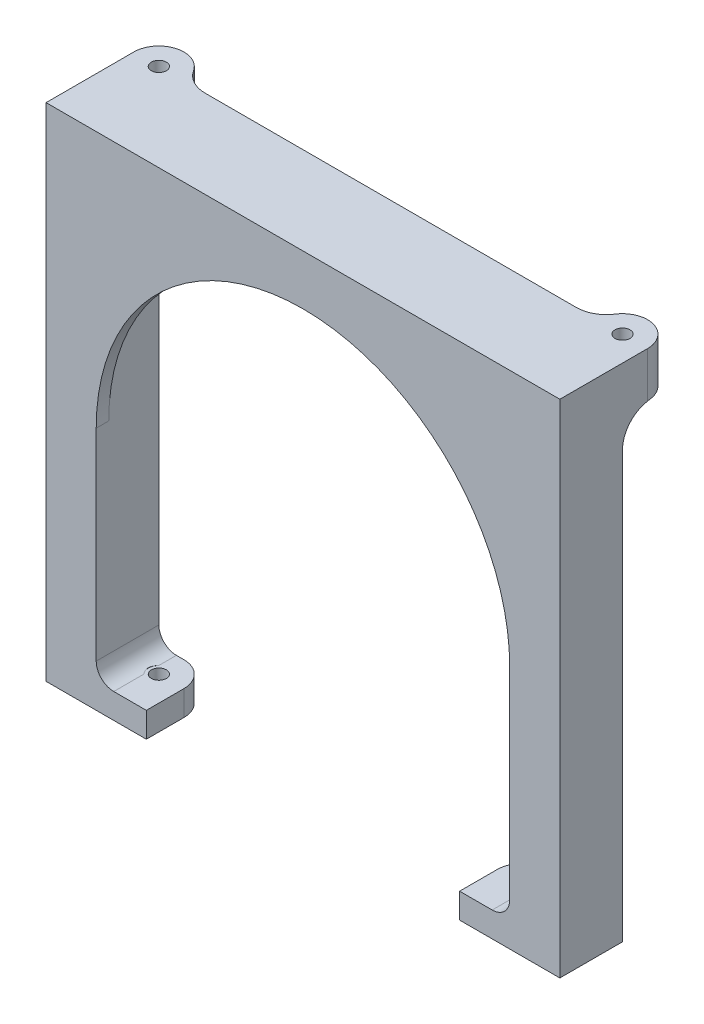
SolidWorks part; units mm, degrees
ref_plane "Front Plane" through (0, 0, 0) normal (0, 0, 1) x (1, 0, 0)
ref_plane "Top Plane" through (0, 0, 0) normal (0, 1, 0) x (1, 0, 0)
ref_plane "Right Plane" through (0, 0, 0) normal (1, 0, 0) x (0, 0, -1)
sketch "Sketch1" plane through (0, 0, 0) normal (0, 1, 0) x (1, 0, 0)
  line L0 (0, 6.35) -> (-19.05, 6.35)
  line L1 (-19.05, 6.35) -> (-19.05, -6.35)
  line L2 (-19.05, -6.35) -> (0, -6.35)
  line L3 (46.0375, 43.0465) -> (46.0375, -42.9885) construction
  line L4 (111.125, -6.35) -> (92.075, -6.35)
  line L5 (111.125, 6.35) -> (111.125, -6.35)
  line L6 (92.075, 6.35) -> (111.125, 6.35)
  line L7 (6.35, 0) -> (6.35, -6.35)
  line L8 (6.35, -6.35) -> (0, -6.35)
  line L9 (85.725, 0) -> (85.725, -6.35)
  line L10 (85.725, -6.35) -> (92.075, -6.35)
  circle A0 centre (0, 0) radius 1.905
  arc A1 (6.35, 0) -> (0, 6.35) centre (0, 0) ccw
  circle A2 centre (92.075, 0) radius 1.905
  arc A3 (85.725, 0) -> (92.075, 6.35) centre (92.075, 0) cw
  dimension "D1" = 46.0375
  dimension "D2" = 3.81
  dimension "D3" = 6.35
extrude "Boss-Extrude1" add sketch "Sketch1" along normal blind 6.35
sketch "Sketch2" plane through (0, 6.35, 0) normal (0, 1, 0) x (1, 0, 0)
  line L0 (-6.35, -6.35) -> (-6.35, 6.35)
  line L1 (98.425, -6.35) -> (98.425, 6.35)
  line L3 (0, 6.35) -> (-19.05, 6.35)
  line L4 (-19.05, 6.35) -> (-19.05, -6.35)
  line L5 (-19.05, -6.35) -> (6.35, -6.35)
  line L6 (-6.35, 6.35) -> (-19.05, 6.35)
  line L7 (-19.05, 6.35) -> (-19.05, -6.35)
  line L8 (-19.05, -6.35) -> (-6.35, -6.35)
  line L9 (111.125, -6.35) -> (111.125, 6.35)
  line L10 (111.125, 6.35) -> (92.075, 6.35)
  line L11 (85.725, -6.35) -> (111.125, -6.35)
  line L12 (111.125, -6.35) -> (111.125, 6.35)
  line L13 (111.125, 6.35) -> (98.425, 6.35)
  line L14 (98.425, -6.35) -> (111.125, -6.35)
  line L18 (6.35, -6.35) -> (6.35, 0)
  line L20 (85.725, 0) -> (85.725, -6.35)
  arc A1 (6.35, 0) -> (0, 6.35) centre (0, 0) ccw
  arc A3 (92.075, 6.35) -> (85.725, 0) centre (92.075, 0) ccw
  point P16 (-6.35, 0)
  point P20 (98.425, 0)
  dimension "D1" = 0
  dimension "D2" = 0
extrude "Boss-Extrude2" add sketch "Sketch2" along normal blind 114.3
sketch "Sketch3" plane through (0, 120.65, 0) normal (0, 1, 0) x (1, 0, 0)
  line L0 (98.425, -6.35) -> (111.125, -6.35) construction
  line L1 (111.125, -6.35) -> (111.125, 6.35) construction
  line L2 (-6.35, 12.7) -> (98.425, 12.7)
  line L3 (98.425, 6.35) -> (98.425, -6.35) construction
  line L4 (-19.05, 6.35) -> (-19.05, -6.35) construction
  line L5 (-19.05, -6.35) -> (-6.35, -6.35) construction
  line L6 (-6.35, -6.35) -> (-6.35, 6.35) construction
  line L7 (-6.35, 6.35) -> (98.425, 6.35)
  line L8 (98.425, -6.35) -> (111.125, -6.35)
  line L9 (111.125, -6.35) -> (111.125, 6.35)
  line L11 (98.425, 6.35) -> (98.425, -6.35)
  line L12 (-19.05, 6.35) -> (-19.05, -6.35)
  line L13 (-19.05, -6.35) -> (-6.35, -6.35)
  line L14 (-6.35, -6.35) -> (-6.35, 6.35)
  line L17 (-19.05, 12.7) -> (-19.05, 6.35)
  line L19 (111.125, 12.7) -> (111.125, 6.35)
  arc A0 (-6.35, 12.7) -> (-19.05, 12.7) centre (-12.7, 12.7) ccw
  arc A1 (6.35, 0) -> (0, 6.35) centre (0, 0) ccw construction
  circle A2 centre (-12.7, 12.7) radius 1.905
  circle A3 centre (0, 0) radius 1.905 construction
  arc A4 (111.125, 12.7) -> (98.425, 12.7) centre (104.775, 12.7) ccw
  arc A5 (92.075, 6.35) -> (85.725, 0) centre (92.075, 0) ccw construction
  circle A6 centre (104.775, 12.7) radius 1.905
  circle A7 centre (92.075, 0) radius 1.905 construction
extrude "Boss-Extrude3" add sketch "Sketch3" along normal blind 6.35
sketch "Sketch6" plane through (0, 127, 0) normal (0, 1, 0) x (1, 0, 0)
  line L1 (-6.35, -6.35) -> (98.425, -6.35)
  line L2 (-6.35, -6.35) -> (-6.35, 6.35)
  line L3 (-6.35, 6.35) -> (98.425, 6.35)
  line L4 (98.425, -6.35) -> (98.425, 6.35)
extrude "Boss-Extrude4" add sketch "Sketch6" against normal blind 12.7
sketch "Sketch7" plane through (0, 0, 6.35) normal (0, 0, 1) x (1, 0, 0)
  line L0 (-6.35, 6.35) -> (6.35, 6.35)
  line L1 (-6.35, 6.35) -> (6.35, 6.35) construction
  line L2 (6.35, 6.35) -> (6.35, 0)
  line L3 (6.35, 0) -> (-19.05, 0)
  line L4 (-19.05, 0) -> (-19.05, 127)
  line L5 (-19.05, 127) -> (111.125, 127)
  line L6 (111.125, 127) -> (111.125, 0)
  line L7 (111.125, 0) -> (85.725, 0)
  line L8 (85.725, 0) -> (85.725, 6.35)
  line L9 (85.725, 6.35) -> (98.425, 6.35)
  line L15 (-6.35, 114.3) -> (-6.35, 6.35) construction
  line L16 (-6.35, 61.9125) -> (-6.35, 6.35)
  line L18 (98.425, 114.3) -> (98.425, 6.35) construction
  line L19 (98.425, 61.9125) -> (98.425, 6.35)
  arc A0 (-6.35, 61.9125) -> (98.425, 61.9125) centre (46.0375, 61.9125) cw
  dimension "D1" = 55.5625
extrude "Boss-Extrude5" add sketch "Sketch7" along normal blind 3.175
fillet "Fillet5" radius 4.445 2 edges at (-6.35, 6.35, 1.5875) (98.425, 6.35, 1.5875)
sketch "Sketch11" plane through (0, 6.35, 0) normal (0, 1, 0) x (1, 0, 0)
  circle A0 centre (92.075, 0) radius 2.667
  circle A1 centre (0, 0) radius 2.667
extrude "Cut-Extrude2" cut sketch "Sketch11" along normal blind 2.54
sketch "Sketch12" plane through (0, 120.65, 0) normal (0, -1, 0) x (1, 0, 0)
  circle A0 centre (104.775, -12.7) radius 3.302
  circle A1 centre (-12.7, -12.7) radius 3.302
sketch "Sketch14" plane through (0, 120.65, 0) normal (0, -1, 0) x (1, 0, 0)
  line L4 (111.125, -12.7) -> (111.125, -6.35)
  line L5 (111.125, -6.35) -> (-19.05, -6.35)
  line L6 (-19.05, -6.35) -> (-19.05, -12.7)
  line L7 (-6.35, -12.7) -> (98.425, -12.7)
  line L8 (111.125, -12.7) -> (111.125, -6.35)
  line L9 (111.125, -6.35) -> (-19.05, -6.35)
  line L10 (-19.05, -6.35) -> (-19.05, -12.7)
  line L11 (-6.35, -12.7) -> (98.425, -12.7)
  circle A0 centre (104.775, -12.7) radius 1.905 construction
  circle A1 centre (-12.7, -12.7) radius 1.905 construction
  arc A2 (-19.05, -12.7) -> (-6.35, -12.7) centre (-12.7, -12.7) ccw
  arc A3 (98.425, -12.7) -> (111.125, -12.7) centre (104.775, -12.7) ccw
  arc A4 (-19.05, -12.7) -> (-6.35, -12.7) centre (-12.7, -12.7) ccw
  arc A5 (98.425, -12.7) -> (111.125, -12.7) centre (104.775, -12.7) ccw
  circle A6 centre (104.775, -12.7) radius 1.905
  circle A7 centre (-12.7, -12.7) radius 1.905
  dimension "D1" = 0
extrude "Boss-Extrude6" add sketch "Sketch14" along normal blind 5.08
fillet "Fillet8" radius 7.62 1 edges at (46.0375, 115.57, -6.35)
fillet "Fillet9" radius 7.62 2 edges at (-6.35, 121.2317, -12.7) (98.425, 121.2317, -12.7)
sketch "Sketch15" plane through (0, 115.57, 0) normal (0, -1, 0) x (1, 0, 0)
  circle A0 centre (-12.7, -12.7) radius 3.302
  circle A1 centre (104.775, -12.7) radius 3.302
extrude "Cut-Extrude4" cut sketch "Sketch15" along normal blind 5.08
